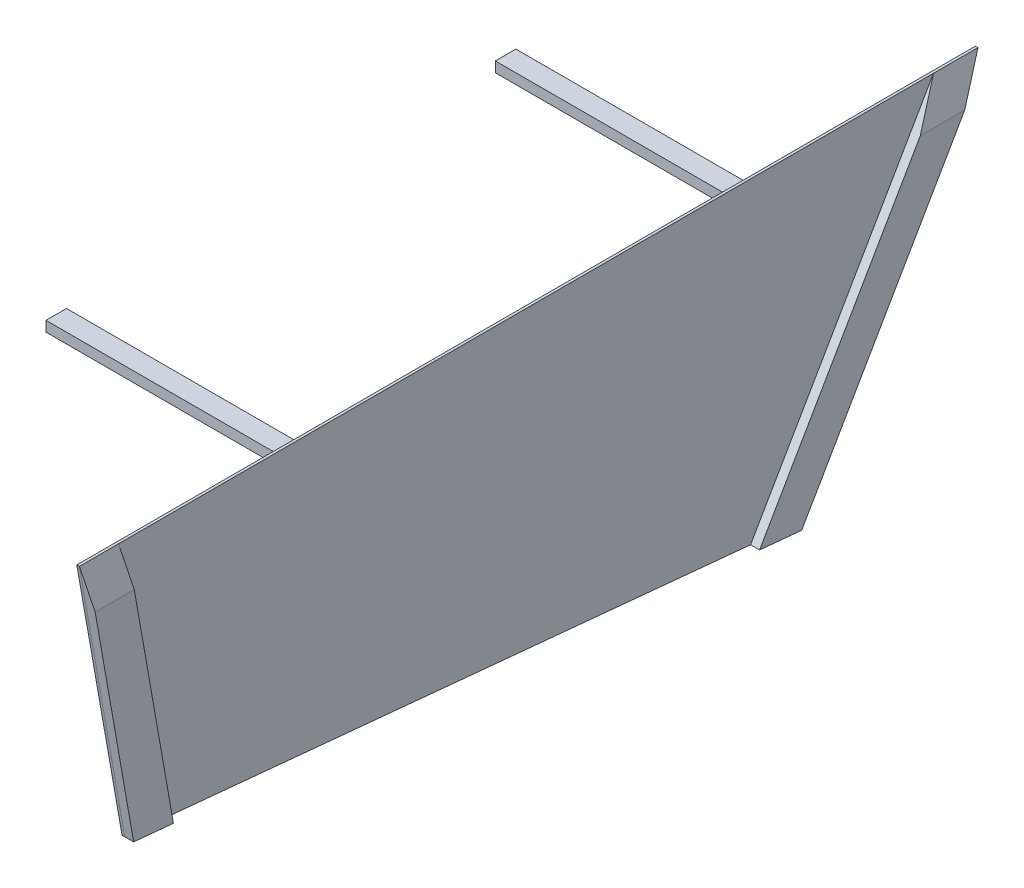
SolidWorks part; units mm, degrees
ref_plane "Front Plane" through (0, 0, 0) normal (0, 0, 1) x (1, 0, 0)
ref_plane "Top Plane" through (0, 0, 0) normal (0, 1, 0) x (1, 0, 0)
ref_plane "Right Plane" through (0, 0, 0) normal (1, 0, 0) x (0, 0, -1)
sketch "Sketch1" plane through (0, 0, 0) normal (1, 0, 0) x (0, 0, -1)
  line L1 (70.6645, -740) -> (2816.9873, -740) construction
  line L3 (-105.6624, 260) -> (3394.3376, 260)
  line L5 (-105.6624, 260) -> (70.6645, -740) construction
  line L6 (3394.3376, 260) -> (-105.6624, 260) construction
  line L7 (3394.3376, 260) -> (2816.9873, -740)
  line L8 (-105.6624, 260) -> (70.6645, -740)
  line L9 (70.6645, -740) -> (2672.6497, -990)
  line L10 (2672.6497, -990) -> (2816.9873, -740)
  dimension "D1" = 1000
  dimension "D2" = 3500
  dimension "D3" = 120
  dimension "D4" = 250
extrude "Boss-Extrude1" add sketch "Sketch1" along normal mid plane 10
sketch "Sketch2" plane through (0, 0, 0) normal (1, 0, 0) x (0, 0, -1)
  line L0 (3394.3376, 260) -> (2459.3376, 260) construction
  line L1 (3394.3376, 260) -> (-105.6624, 260) construction
  line L2 (2459.3376, 260) -> (709.3376, 260) construction
  line L3 (709.3376, 260) -> (709.3376, 230) construction
  line L4 (2459.3376, 260) -> (2459.3376, 230) construction
  line L7 (2419.3376, 210) -> (2499.3376, 210)
  line L12 (2419.3376, 210) -> (2419.3376, 250)
  line L13 (2419.3376, 250) -> (2499.3376, 250)
  line L18 (2499.3376, 210) -> (2499.3376, 250)
  line L19 (2419.3376, 210) -> (2499.3376, 250) construction
  line L24 (2419.3376, 250) -> (2499.3376, 210) construction
  line L25 (669.3376, 210) -> (749.3376, 210)
  line L30 (669.3376, 210) -> (669.3376, 250)
  line L31 (669.3376, 250) -> (749.3376, 250)
  line L32 (749.3376, 210) -> (749.3376, 250)
  line L33 (669.3376, 210) -> (749.3376, 250) construction
  line L34 (669.3376, 250) -> (749.3376, 210) construction
  point P11 (2459.3376, 230)
  point P14 (709.3376, 230)
  dimension "D1" = 935
  dimension "D2" = 1750
  dimension "D3" = 30
  dimension "D4" = 30
  dimension "D5" = 80
  dimension "D6" = 40
  dimension "D7" = 80
  dimension "D8" = 40
extrude "Boss-Extrude2" add sketch "Sketch2" against normal blind 900
sketch "Sketch5" plane through (5, 0, 0) normal (1, 0, 0) x (0, 0, -1)
  line L0 (-105.6624, 260) -> (70.6645, -740)
  line L1 (46.6516, 260) -> (225.6034, -754.8866)
  line L3 (3394.3376, 260) -> (-105.6624, 260) construction
  line L4 (46.6516, 260) -> (-105.6624, 260)
  line L5 (225.6034, -754.8866) -> (70.6645, -740)
  line L6 (3394.3376, 260) -> (2672.6497, -990)
  line L7 (2672.6497, -990) -> (2508.5477, -974.233)
  line L8 (2508.5477, -974.233) -> (3221.1325, 260)
  line L9 (3221.1325, 260) -> (3394.3376, 260)
  line L10 (-105.6624, 260) -> (70.6645, -740) construction
  line L11 (-105.6624, 260) -> (70.6645, -740) construction
  line L12 (70.6645, -740) -> (2672.6497, -990) construction
  line L13 (2672.6497, -990) -> (3394.3376, 260) construction
  dimension "D1" = 150
  dimension "D2" = 150
extrude "Boss-Extrude3" add sketch "Sketch5" along normal blind 35 separate body
chamfer "Chamfer1" distance 35 distance2 150 1 edges at (40, 260, 29.5054)
chamfer "Chamfer2" distance 35 distance2 150 1 edges at (40, 260, -3307.735)
